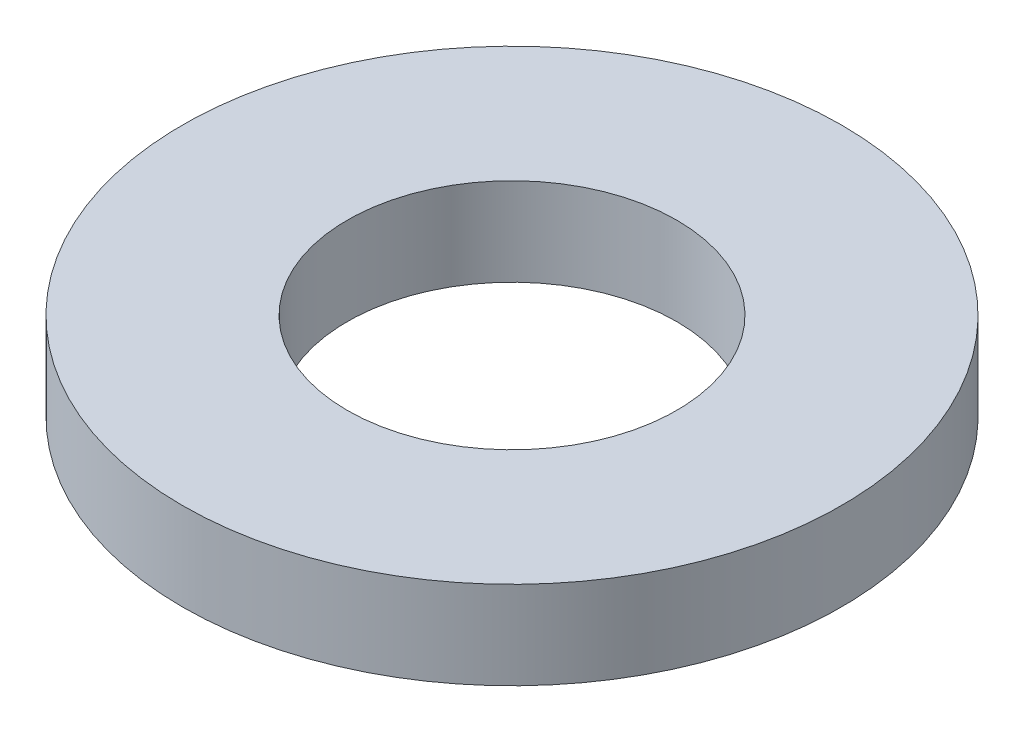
SolidWorks part; units mm, degrees
ref_plane "Plan de face" through (0, 0, 0) normal (0, 0, 1) x (1, 0, 0)
ref_plane "Plan de dessus" through (0, 0, 0) normal (0, 1, 0) x (1, 0, 0)
ref_plane "Plan de droite" through (0, 0, 0) normal (1, 0, 0) x (0, 0, -1)
sketch "Esquisse1" plane through (0, 0, 0) normal (0, 1, 0) x (1, 0, 0)
  circle A0 centre (0, 0) radius 1.5
  circle A1 centre (0, 0) radius 3
extrude "Extrusion1" add sketch "Esquisse1" along normal blind 0.8
